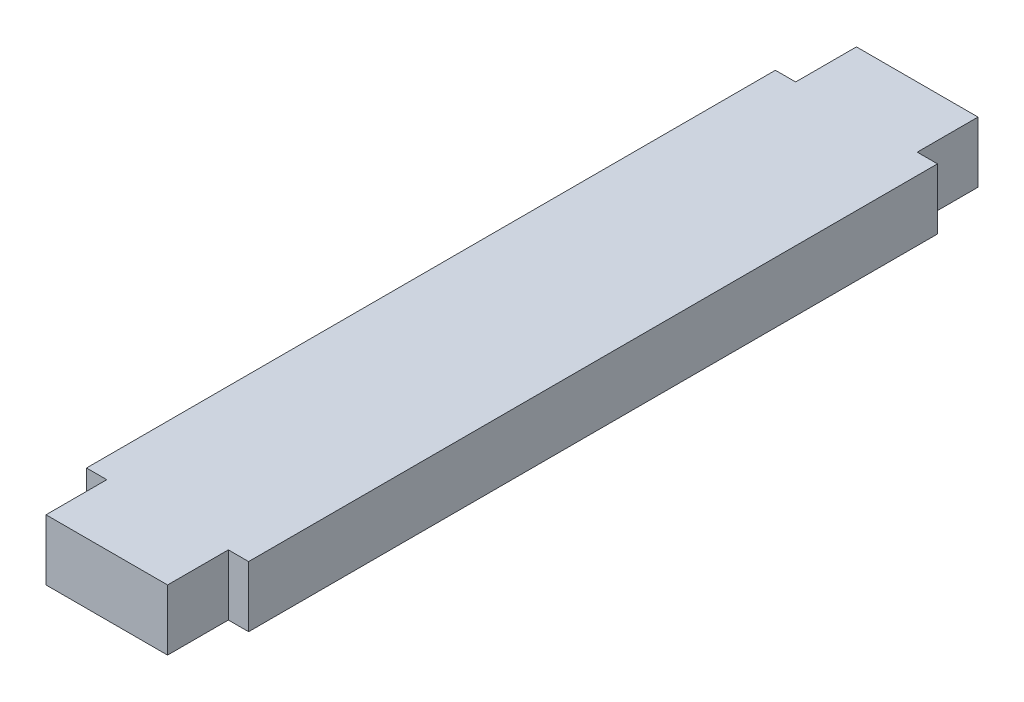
SolidWorks part; units mm, degrees
ref_plane "Front Plane" through (0, 0, 0) normal (0, 0, 1) x (1, 0, 0)
ref_plane "Top Plane" through (0, 0, 0) normal (0, 1, 0) x (1, 0, 0)
ref_plane "Right Plane" through (0, 0, 0) normal (1, 0, 0) x (0, 0, -1)
sketch "Sketch1" plane through (0, 0, 0) normal (0, 1, 0) x (1, 0, 0)
  line L0 (15, 225.8088) -> (15, -14.0666) construction
  line L1 (0, 0) -> (30, 0)
  line L2 (0, 0) -> (0, 15)
  line L3 (0, 200) -> (30, 200)
  line L4 (30, 0) -> (30, 15)
  line L5 (-5, 185) -> (0, 185)
  line L6 (-5, 185) -> (-5, 15)
  line L7 (-5, 15) -> (0, 15)
  line L8 (35, 185) -> (35, 15)
  line L9 (-41.9252, 100) -> (59.139, 100) construction
  line L10 (0, 185) -> (0, 200)
  line L11 (30, 185) -> (30, 200)
  line L12 (30, 185) -> (35, 185)
  line L13 (30, 15) -> (35, 15)
  dimension "D1" = 200
  dimension "D2" = 30
  dimension "D3" = 170
  dimension "D4" = 40
extrude "Boss-Extrude1" add sketch "Sketch1" along normal blind 15
